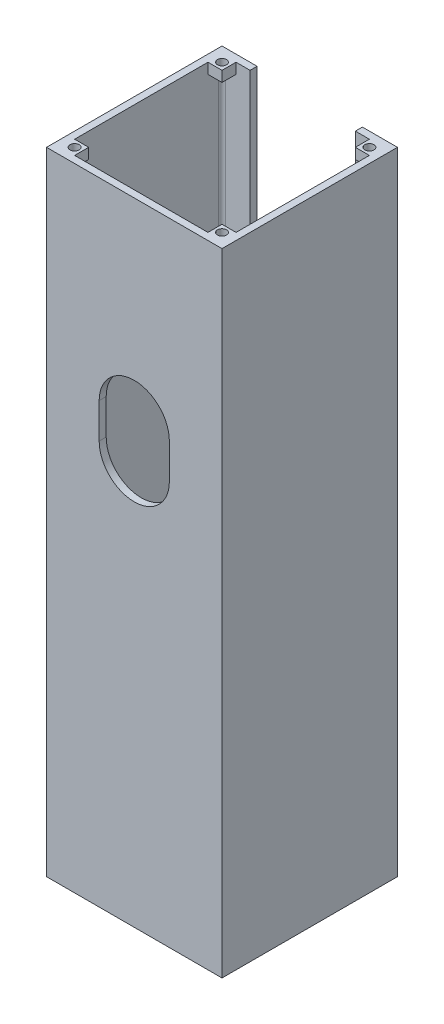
SolidWorks part; units mm, degrees
ref_plane "Front Plane" through (0, 0, 0) normal (0, 0, 1) x (1, 0, 0)
ref_plane "Top Plane" through (0, 0, 0) normal (0, 1, 0) x (1, 0, 0)
ref_plane "Right Plane" through (0, 0, 0) normal (1, 0, 0) x (0, 0, -1)
sketch "Sketch2" plane through (0, 0, 0) normal (0, 1, 0) x (1, 0, 0)
  line L1 (0, 0) -> (63.5, 0)
  line L2 (0, 0) -> (0, 63.5)
  line L3 (0, 63.5) -> (63.5, 63.5)
  line L4 (63.5, 0) -> (63.5, 63.5)
extrude "Boss-Extrude2" add sketch "Sketch2" against normal blind 304.8
sketch "Sketch3" plane through (0, 0, 0) normal (0, 1, 0) x (1, 0, 0)
  line L0 (0, 0) -> (0, 2.54)
  line L1 (0, 63.5) -> (0, 0) construction
  line L2 (0, 2.54) -> (2.54, 2.54)
  line L3 (63.5, 63.5) -> (63.5, 60.96)
  line L4 (63.5, 60.96) -> (60.96, 60.96)
  line L6 (2.54, 2.54) -> (60.96, 2.54)
  line L7 (2.54, 2.54) -> (2.54, 60.96)
  line L8 (2.54, 60.96) -> (60.96, 60.96)
  line L9 (60.96, 2.54) -> (60.96, 60.96)
extrude "Cut-Extrude2" cut sketch "Sketch3" against normal blind 302.26 contours L6 L9 L8 L7
sketch3d "3DSketch1"
  line L0 (0, 0, -63.5) -> (0, 0, 0) construction
  point P0 (0, 0, -61.7439)
sketch "Sketch5" plane through (0, 0, 0) normal (0, 1, 0) x (1, 0, 0)
  line L1 (0, 0) -> (63.5, 0)
  line L2 (0, 0) -> (0, 63.5)
  line L3 (0, 63.5) -> (63.5, 63.5)
  line L4 (63.5, 0) -> (63.5, 63.5)
extrude "Cut-Extrude3" cut sketch "Sketch5" against normal blind 2.54
sketch "Sketch6" plane through (0, 0, 0) normal (0, 0, 1) x (1, 0, 0)
  line L0 (0, -304.8) -> (63.5, -304.8)
  line L1 (63.5, -304.8) -> (31.75, -304.8)
  line L2 (31.75, -304.8) -> (31.75, -152.4)
  circle A0 centre (31.75, -152.4) radius 12.7
extrude "Cut-Extrude4" cut sketch "Sketch6" against normal blind 12.7
sketch "Sketch11" plane through (0, 0, 0) normal (0, 0, 1) x (1, 0, 0)
  line L0 (31.75, -152.4) -> (31.75, -158.75)
  line L1 (44.45, -152.4) -> (44.45, -173.6752)
  line L2 (19.05, -152.4) -> (19.05, -158.75)
  circle A0 centre (31.75, -152.4) radius 12.7 construction
  circle A1 centre (31.75, -158.75) radius 12.7
extrude "Cut-Extrude7" cut sketch "Sketch11" against normal blind 2.54 contours A1 L2 M3 | A1 M3 | A1 L1 M3
sketch "Sketch12" plane through (0, 0, 0) normal (0, 0, 1) x (1, 0, 0)
  line L0 (31.75, -152.4) -> (31.75, -146.05)
  line L1 (19.05, -146.05) -> (19.05, -155.575)
  line L2 (19.05, -152.4) -> (19.05, -158.75) construction
  line L3 (44.45, -146.05) -> (44.45, -158.75)
  circle A0 centre (31.75, -146.05) radius 12.7
extrude "Cut-Extrude8" cut sketch "Sketch12" against normal blind 2.54 contours A0 M3 | A0 L1 M3 | A0 L3 M3
sketch "Sketch14" plane through (0, 0, -63.5) normal (0, 0, -1) x (-1, 0, 0)
  line L0 (-63.5, -304.8) -> (-50.8, -304.8)
  line L1 (-63.5, -304.8) -> (0, -304.8) construction
  line L2 (-50.8, -304.8) -> (-50.8, -292.1)
  line L3 (0, -2.54) -> (0, -15.24)
  line L4 (0, -304.8) -> (0, -2.54) construction
  line L5 (0, -15.24) -> (-12.7, -15.24)
  line L7 (-12.7, -15.24) -> (-50.8, -15.24)
  line L8 (-12.7, -15.24) -> (-12.7, -292.1)
  line L9 (-12.7, -292.1) -> (-50.8, -292.1)
  line L10 (-50.8, -15.24) -> (-50.8, -292.1)
extrude "Cut-Extrude9" cut sketch "Sketch14" against normal blind 2.54 contours L7 L10 L9 L8
fillet "Fillet1" radius 1.27 4 edges at (2.54, -152.4, -2.54) (2.54, -152.4, -60.96) (60.96, -152.4, -60.96) (60.96, -152.4, -2.54)
ref_plane "Plane1" through (63.5, -2.54, 0) normal (0, 1, 0) x (1, 0, 0)
sketch "Sketch15" plane through (63.5, -2.54, 0) normal (0, 1, 0) x (1, 0, 0)
  line L1 (-63.5, 0) -> (0, 0)
  line L2 (-63.5, 0) -> (-63.5, 63.5)
  line L3 (-63.5, 63.5) -> (0, 63.5)
  line L4 (0, 0) -> (0, 63.5)
extrude "Cut-Extrude10" cut sketch "Sketch15" against normal blind 73.66
sketch "Sketch16" plane through (0, -76.2, 0) normal (0, 1, 0) x (1, 0, 0)
  line L0 (3.81, 60.96) -> (2.54, 60.96)
  line L1 (2.54, 60.96) -> (2.54, 59.69)
  line L2 (59.69, 60.96) -> (60.96, 60.96)
  line L3 (2.54, 60.96) -> (7.62, 60.96)
  line L4 (2.54, 60.96) -> (2.54, 55.88)
  line L5 (2.54, 55.88) -> (7.62, 55.88)
  line L6 (7.62, 60.96) -> (7.62, 55.88)
  line L7 (60.96, 60.96) -> (60.96, 59.69)
  line L8 (59.69, 2.54) -> (60.96, 2.54)
  line L9 (60.96, 60.96) -> (55.88, 60.96)
  line L10 (60.96, 60.96) -> (60.96, 55.88)
  line L11 (60.96, 55.88) -> (55.88, 55.88)
  line L12 (55.88, 60.96) -> (55.88, 55.88)
  line L13 (60.96, 2.54) -> (60.96, 3.81)
  line L14 (3.81, 2.54) -> (2.54, 2.54)
  line L15 (60.96, 2.54) -> (55.88, 2.54)
  line L16 (60.96, 2.54) -> (60.96, 7.62)
  line L17 (60.96, 7.62) -> (55.88, 7.62)
  line L18 (55.88, 2.54) -> (55.88, 7.62)
  line L19 (2.54, 2.54) -> (2.54, 3.81)
  line L21 (2.54, 2.54) -> (7.62, 2.54)
  line L22 (2.54, 2.54) -> (2.54, 7.62)
  line L23 (2.54, 7.62) -> (7.62, 7.62)
  line L24 (7.62, 2.54) -> (7.62, 7.62)
  circle A0 centre (5.08, 5.08) radius 1.651
  circle A1 centre (58.42, 5.08) radius 1.651
  circle A2 centre (58.42, 58.42) radius 1.651
  circle A3 centre (5.08, 58.42) radius 1.651
extrude "Boss-Extrude3" add sketch "Sketch16" against normal blind 3.81 contours L6 L5 A3 M37 M36 M35 | L12 L11 A2 M29 M31 M30 | L24 L23 A0 M33 M35 M34 | L15 L18 L17 L16
sketch "Sketch17" plane through (0, -76.2, 0) normal (0, 1, 0) x (1, 0, 0)
  line L0 (55.88, 2.54) -> (60.96, 7.62)
  line L1 (60.96, 3.81) -> (60.96, 59.69) construction
  line L2 (60.96, 7.62) -> (60.96, 55.88) construction
  line L3 (60.96, 7.62) -> (55.88, 7.62)
  line L4 (55.88, 7.62) -> (60.96, 2.54)
  circle A0 centre (58.42, 5.08) radius 1.651
extrude "Cut-Extrude11" cut sketch "Sketch17" against normal blind 3.81 contours L0 A0 L4 | L4 A0 L0 | L0 A0 L4 | L4 A0 L0
